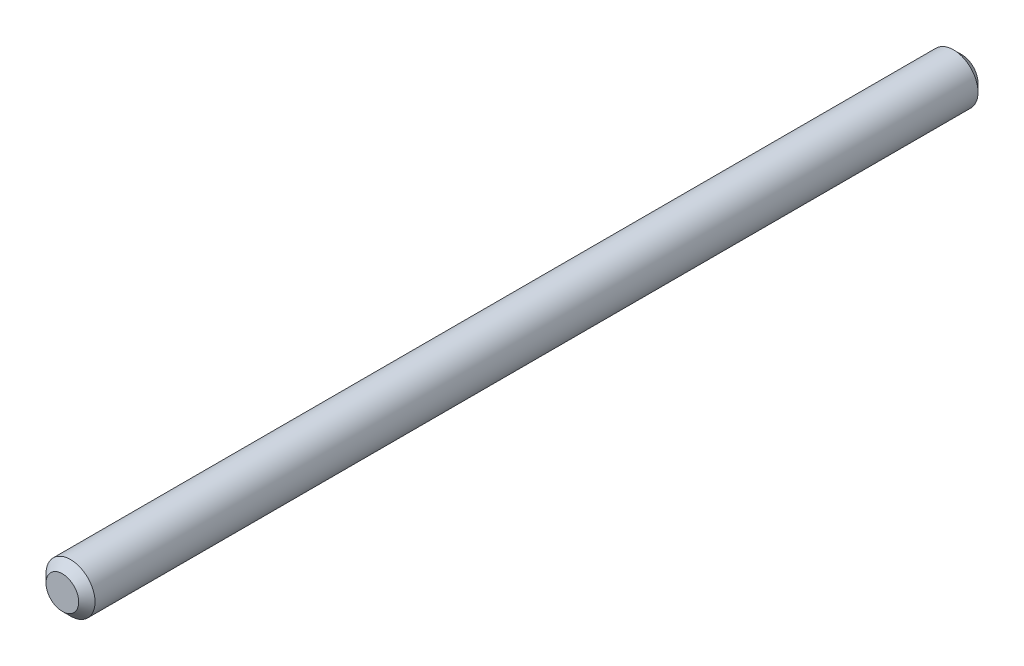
SolidWorks part; units mm, degrees
ref_plane "Face" through (0, 0, 0) normal (0, 0, 1) x (1, 0, 0)
ref_plane "Dessus" through (0, 0, 0) normal (0, 1, 0) x (1, 0, 0)
ref_plane "Droite" through (0, 0, 0) normal (1, 0, 0) x (0, 0, -1)
sketch "Esquisse1" plane through (0, 0, 0) normal (0, 0, 1) x (1, 0, 0)
  circle A0 centre (0, 0) radius 1.5
extrude "Base-Extrusion" add sketch "Esquisse1" along normal blind 55
chamfer "Chanfrein1" distance 0.5 angle 45 2 edges at (1.5, 0, 0) (1.5, 0, 55)
